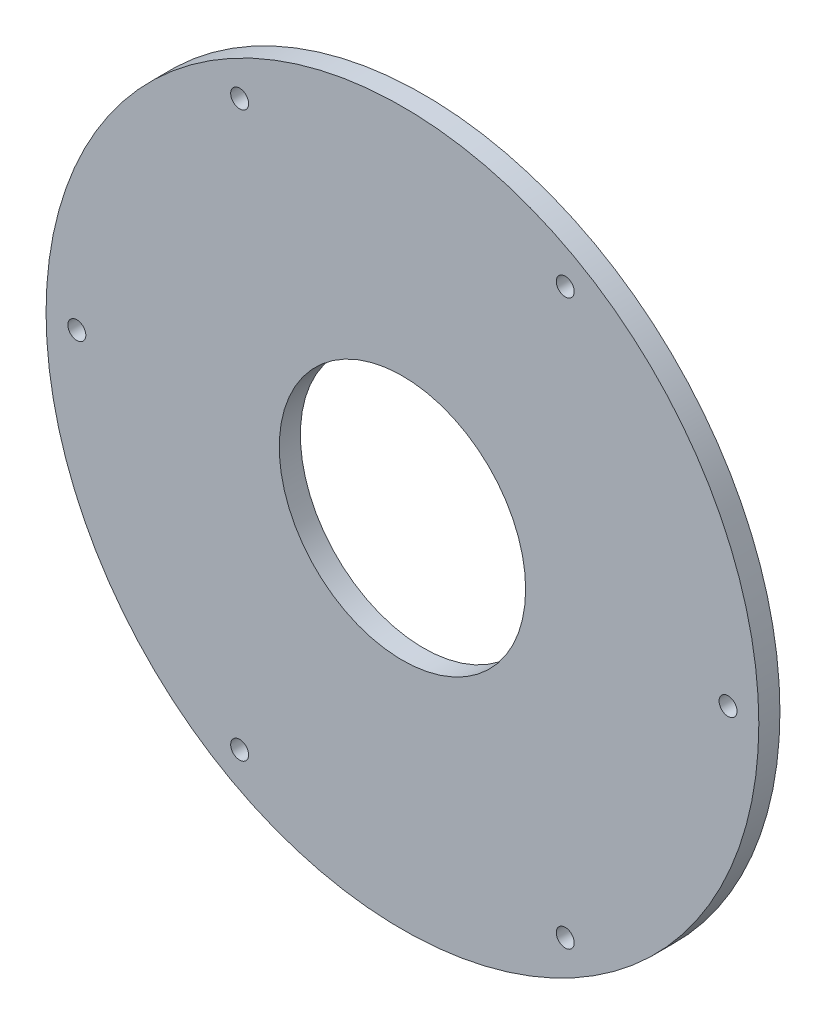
SolidWorks part; units mm, degrees
ref_plane "Front Plane" through (0, 0, 0) normal (0, 0, 1) x (1, 0, 0)
ref_plane "Top Plane" through (0, 0, 0) normal (0, 1, 0) x (1, 0, 0)
ref_plane "Right Plane" through (0, 0, 0) normal (1, 0, 0) x (0, 0, -1)
sketch "Sketch1" plane through (0, 0, 0) normal (0, 0, 1) x (1, 0, 0)
  circle A0 centre (0, 0) radius 70
  circle A1 centre (0, 0) radius 202.5
  dimension "D1" = 140
  dimension "D2" = 405
extrude "Boss-Extrude1" add sketch "Sketch1" along normal blind 12
hole_wizard "M12 Tapped Hole1" positions "Sketch2" profile "Sketch3" tap size "M12" standard "DIN"
sketch "Sketch2" plane through (0, 0, 12) normal (0, 0, 1) x (1, 0, 0)
  line L0 (0, 0) -> (-185, 0) construction
  point P0 (-185, 0)
  dimension "D1" = 185
sketch "Sketch3" plane through (-185, 0, 12) normal (1, 0, 0) x (0, -1, 0)
  line L0 (0, 0) -> (0, 12)
  line L1 (0, 12) -> (5.1, 12)
  line L2 (5.1, 12) -> (5.1, 0)
  line L5 (5.1, 0) -> (0, 0)
  line L11 (0, -6.35) -> (0, 107.95) construction
  dimension "Thru Tap Drill Dia." = 10.2
  dimension "Thru Tap Drill Depth" = 12
pattern_circular "CirPattern1" count 6 over 360 about axis through (0, 0, 0) along (0, 0, 1) of "M12 Tapped Hole1"
